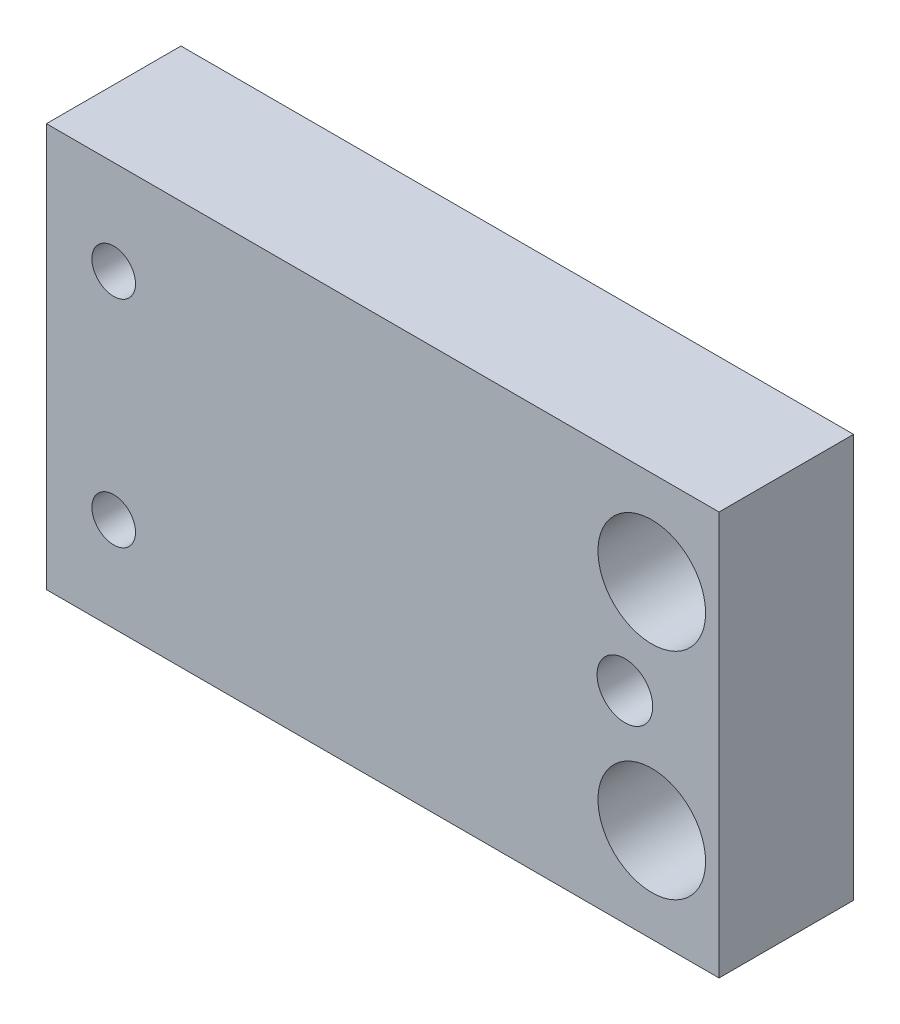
SolidWorks part; units mm, degrees
ref_plane "Face" through (0, 0, 0) normal (0, 0, 1) x (1, 0, 0)
ref_plane "Dessus" through (0, 0, 0) normal (0, 1, 0) x (1, 0, 0)
ref_plane "Droite" through (0, 0, 0) normal (1, 0, 0) x (0, 0, -1)
ref_plane "Plan1" through (0, 0, 0) normal (0, 0, 1) x (1, 0, 0)
sketch "Esquisse1" plane through (0, 0, 0) normal (0, 0, 1) x (1, 0, 0)
  line L0 (-25, 15) -> (-25, -15)
  line L1 (-25, -15) -> (25, -15)
  line L2 (25, -15) -> (25, 15)
  line L3 (25, 15) -> (-25, 15)
extrude "Boss.-Extru.1" add sketch "Esquisse1" along normal blind 10
ref_plane "Plan2" through (0, 0, 0) normal (0, 1, 0) x (-1, 0, 0)
sketch "Esquisse2" plane through (0, 0, 0) normal (0, 1, 0) x (-1, 0, 0)
  line L0 (-18, 0) -> (-20.067, 0)
  line L1 (-20.067, 0) -> (-20.067, 10)
  line L2 (-20.067, 10) -> (-18, 10)
  line L3 (-18, 10) -> (-18, 0)
  line L4 (-18, 10) -> (-18, 0) construction
revolve "Enlèvement de matière-Révolution1" cut sketch "Esquisse2" angle 360 about L4
ref_plane "Plan3" through (0, 8, 0) normal (0, 1, 0) x (-1, 0, 0)
sketch "Esquisse3" plane through (0, 8, 0) normal (0, 1, 0) x (-1, 0, 0)
  line L0 (20, 10) -> (21.621, 10)
  line L1 (21.621, 10) -> (21.621, 0)
  line L2 (21.621, 0) -> (20, 0)
  line L3 (20, 0) -> (20, 10)
  line L4 (20, 0) -> (20, 10) construction
revolve "Enlèvement de matière-Révolution2" cut sketch "Esquisse3" angle 360 about L4
ref_plane "Plan4" through (0, -8, 0) normal (0, 1, 0) x (-1, 0, 0)
sketch "Esquisse4" plane through (0, -8, 0) normal (0, 1, 0) x (-1, 0, 0)
  line L0 (20, 10) -> (21.621, 10)
  line L1 (21.621, 10) -> (21.621, 0)
  line L2 (21.621, 0) -> (20, 0)
  line L3 (20, 0) -> (20, 10)
  line L4 (20, 0) -> (20, 10) construction
revolve "Enlèvement de matière-Révolution3" cut sketch "Esquisse4" angle 360 about L4
ref_plane "Plan5" through (0, 0, 0) normal (0, 0, 1) x (1, 0, 0)
sketch "Esquisse5" plane through (0, 0, 0) normal (0, 0, 1) x (1, 0, 0)
  circle A0 centre (20, 8) radius 4
extrude "Enlèv. mat.-Extru.1" cut sketch "Esquisse5" along normal blind 10
ref_plane "Plan6" through (0, 0, 0) normal (0, 0, 1) x (1, 0, 0)
sketch "Esquisse6" plane through (0, 0, 0) normal (0, 0, 1) x (1, 0, 0)
  circle A0 centre (20, -8) radius 4
extrude "Enlèv. mat.-Extru.2" cut sketch "Esquisse6" along normal blind 10
